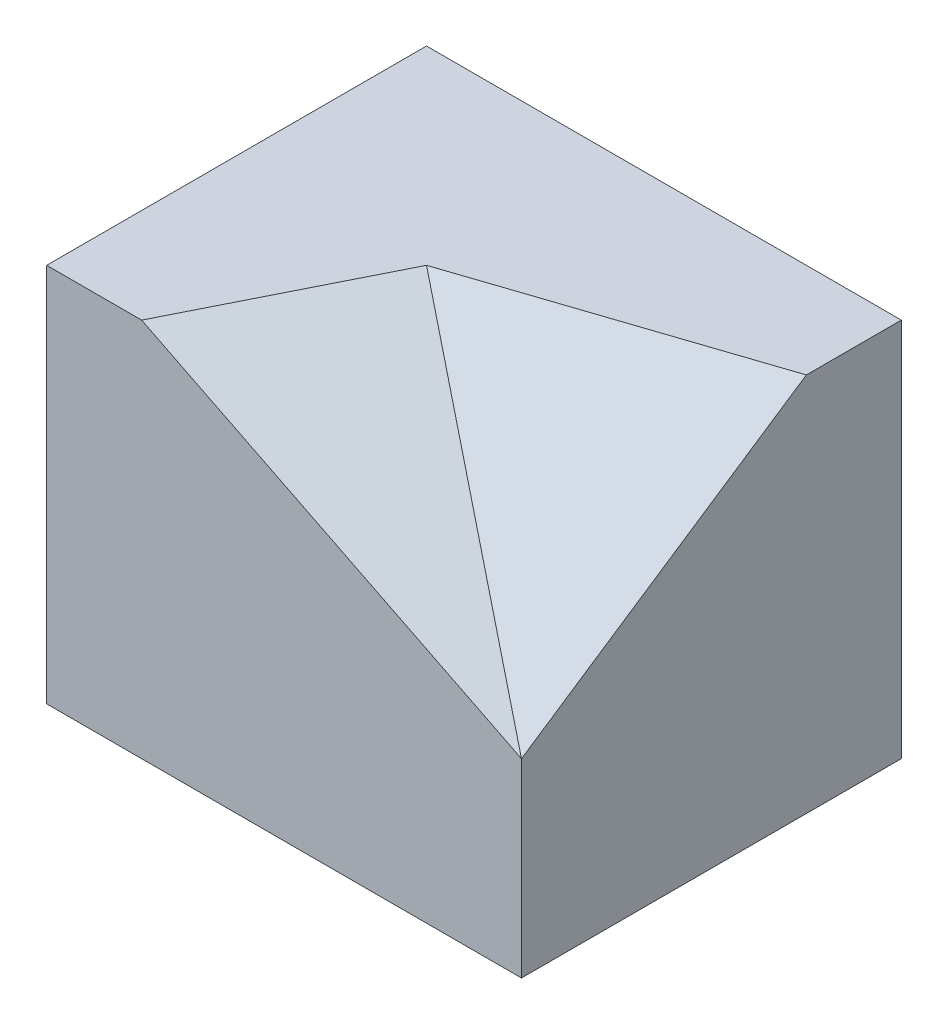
SolidWorks part; units mm, degrees
ref_plane "Front Plane" through (0, 0, 0) normal (0, 0, 1) x (1, 0, 0)
ref_plane "Top Plane" through (0, 0, 0) normal (0, 1, 0) x (1, 0, 0)
ref_plane "Right Plane" through (0, 0, 0) normal (1, 0, 0) x (0, 0, -1)
sketch "Sketch1" plane through (0, 0, 0) normal (0, 1, 0) x (1, 0, 0)
  line L0 (-25, -20) -> (25, 20) construction
  line L1 (-25, -20) -> (25, -20)
  line L2 (-25, -20) -> (-25, 20)
  line L3 (-25, 20) -> (25, 20)
  line L4 (25, -20) -> (25, 20)
  dimension "D1" = 50
  dimension "D2" = 40
extrude "Extrude1" add sketch "Sketch1" along normal mid plane 40
sketch "Sketch2" plane through (0, 20, 0) normal (0, 1, 0) x (1, 0, 0)
  line L0 (-15, -20) -> (-5, 0)
  line L1 (-25, -20) -> (25, -20) construction
  line L2 (-5, 0) -> (25, 10)
  line L3 (25, -20) -> (25, 20) construction
  line L4 (25, 10) -> (25, -20)
  line L5 (25, -20) -> (-15, -20)
  dimension "D1" = 40
  dimension "D2" = 30
  dimension "D3" = 20
  dimension "D4" = 30
sketch "Sketch3" plane through (0, 0, 0) normal (0, 1, 0) x (1, 0, 0)
  point P0 (25, -20)
loft "Cut-Loft1" cut profiles "Sketch2", "Sketch3"
